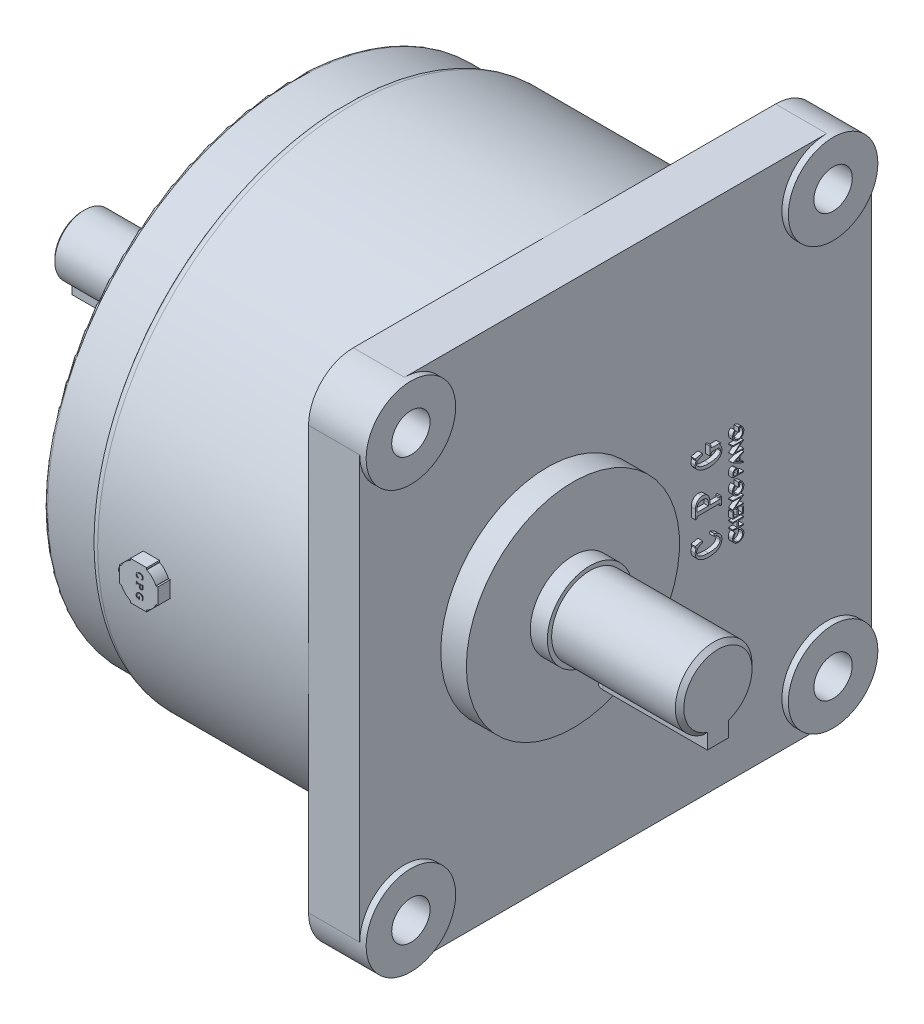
SolidWorks part; units mm, degrees
ref_plane "前视基准面" through (0, 0, 0) normal (0, 0, 1) x (1, 0, 0)
ref_plane "上视基准面" through (0, 0, 0) normal (0, 1, 0) x (1, 0, 0)
ref_plane "右视基准面" through (0, 0, 0) normal (1, 0, 0) x (0, 0, -1)
sketch "草图1" plane through (0, 0, 0) normal (0, 1, 0) x (1, 0, 0)
  line L0 (0, 0) -> (15.7361, 0) construction
  line L1 (0, 0) -> (0, -9)
  line L2 (0, -9) -> (-30, -9)
  line L3 (-30, -9) -> (-30, -10)
  line L4 (-30, -10) -> (-34, -10)
  line L5 (-34, -10) -> (-34, -25)
  line L6 (-34, -25) -> (-40, -25)
  line L7 (-40, -25) -> (-40, 0)
  line L8 (-40, 0) -> (0, 0)
  dimension "D1" = 30
  dimension "D2" = 18
  dimension "D3" = 20
  dimension "D4" = 6
  dimension "D5" = 50
  dimension "D6" = 40
revolve "旋转1" add sketch "草图1" angle 360 about L0
sketch "草图2" plane through (0, 0, 0) normal (0, 1, 0) x (1, 0, 0)
  line L0 (8.0167, 16) -> (-52, 16) construction
  line L1 (-40, 25) -> (-40, -25) construction
  line L4 (-52, 16) -> (-52, -44)
  line L5 (-52, -44) -> (-103.46, -44)
  line L6 (-103.46, 16) -> (-103.46, -44)
  line L11 (-52, 16) -> (-103.46, 16)
  dimension "D1" = 16
  dimension "D2" = 12
  dimension "D3" = 120
  dimension "D5" = 51.46
revolve "旋转2" add sketch "草图2" angle 360 about L0
sketch "草图12" plane through (-52, 0, 0) normal (1, 0, 0) x (0, 0, -1)
  line L0 (-44, -60) -> (76, 60) construction
  line L1 (-44, -60) -> (76, -60)
  line L2 (-44, -60) -> (-44, 60)
  line L3 (-44, 60) -> (76, 60)
  line L4 (76, -60) -> (76, 60)
  line L5 (-44, 60) -> (76, -60) construction
  circle A0 centre (16, 0) radius 60 construction
  point P4 (16, 0)
  dimension "D1" = 120
  dimension "D2" = 120
extrude "拉伸8" add sketch "草图12" along normal up to surface (12 mm away)
sketch "草图5" plane through (0, 0, 0) normal (0, 1, 0) x (1, 0, 0)
  line L0 (0, -2.5) -> (-24.5, -2.5)
  line L1 (0, -9) -> (0, 9) construction
  line L2 (-24.5, 2.5) -> (0, 2.5)
  line L3 (0, 2.5) -> (0, -2.5)
  line L4 (20.2, -13.7955) -> (20.2, 19.6443) construction
  arc A0 (-24.5, -2.5) -> (-24.5, 2.5) centre (-24.5, 0) cw
  dimension "D2" = 27
  dimension "D1" = 5
  dimension "D3" = 20.2
extrude "拉伸4" add sketch "草图5" against normal blind 11.2
fillet "圆角1" radius 2 1 edges at (-103.46, 0, -76)
chamfer "倒角1" distance 1 angle 45 1 edges at (0, 9, 0)
fillet "圆角3" radius 10.5 4 edges at (-46, 60, -76) (-46, -60, -76) (-46, -60, 44) (-46, 60, 44)
sketch "草图14" plane through (-40, 0, 0) normal (1, 0, 0) x (0, 0, -1)
  line L0 (-33.5, 60) -> (65.5, 60) construction
  line L1 (-44, -49.5) -> (-44, 49.5) construction
  line L2 (65.5, -60) -> (-33.5, -60) construction
  line L3 (76, 49.5) -> (76, -49.5) construction
  circle A0 centre (-33.5, 49.5) radius 10.5
  circle A1 centre (65.5, 49.5) radius 10.5
  circle A2 centre (-33.5, -49.5) radius 10.5
  circle A3 centre (65.5, -49.5) radius 10.5
  dimension "D1" = 21
extrude "拉伸10" add sketch "草图14" along normal blind 1.5
sketch "草图13" plane through (-38.5, 0, 0) normal (1, 0, 0) x (0, 0, -1)
  line L0 (-33.5, 49.4949) -> (65.5, 49.4949) construction
  line L1 (0, 0) -> (40.9287, 0) construction
  line L2 (-33.5, 60) -> (65.5, 60) construction
  circle A0 centre (-33.5, 49.4949) radius 4.5
  circle A1 centre (65.5, -49.4949) radius 4.5
  circle A2 centre (65.5, 49.4949) radius 4.5
  circle A3 centre (-33.5, -49.4949) radius 4.5
  circle A4 centre (16, 0) radius 70 construction
  dimension "D1" = 33.5
  dimension "D2" = 65.5
  dimension "D4" = 9
  dimension "D3" = 140
extrude "切除-拉伸3" cut sketch "草图13" against normal blind 15
sketch "草圖1" plane through (0, 0, 0) normal (0, 1, 0) x (1, 0, 0)
  line L0 (-141.504, 23) -> (-164.504, 23)
  line L1 (-164.504, 23) -> (-165.004, 22.5)
  line L2 (-165.004, 22.5) -> (-165.004, 16)
  line L3 (-138.004, 41.2) -> (-138.004, 23.25)
  line L4 (-140.004, 22.95) -> (-141.504, 22.95)
  line L5 (-140.004, 22.95) -> (-139.504, 23.25)
  line L6 (-139.504, 23.25) -> (-138.004, 23.25)
  line L7 (-103.96, 74) -> (-115.204, 74)
  line L8 (-129.3516, 42) -> (-137.204, 42)
  line L9 (-116.3837, 50.0851) -> (-128.7313, 42.2156)
  line L10 (-179.3544, 16) -> (-77.5909, 16) construction
  line L11 (-103.46, 73.5) -> (-103.46, 16)
  line L13 (-165.004, 16) -> (-103.46, 16)
  line L14 (-116.004, 73.2) -> (-116.004, 50.8695)
  line L15 (-141.504, 23) -> (-141.504, 22.95)
  arc A0 (-137.204, 42) -> (-138.004, 41.2) centre (-137.204, 41.2) ccw
  arc A3 (-129.3516, 42) -> (-128.7313, 42.2156) centre (-129.3516, 43) ccw
  arc A6 (-116.3837, 50.0851) -> (-116.004, 50.8695) centre (-117.004, 50.8695) ccw
  arc A7 (-115.204, 74) -> (-116.004, 73.2) centre (-115.204, 73.2) ccw
  arc A8 (-103.46, 73.5) -> (-103.96, 74) centre (-103.96, 73.5) ccw
  dimension "D1" = 16
  dimension "D2" = 116
  dimension "D3" = 14
  dimension "D4" = 25
  dimension "D5" = 165.004
revolve "旋轉1" add sketch "草圖1" angle 360 about L10
ref_plane "平面2" through (0, 0, -16) normal (0, 0, 1) x (1, 0, 0)
sketch "草圖4"
  dimension "D1" = 50
  dimension "D2" = 50
  dimension "D3" = 40
  dimension "D4" = 45
  dimension "D5" = 25
extrude "伸長2" add sketch "草圖4" along normal blind 1
sketch "草圖5" plane through (0, 0, 0) normal (0, 1, 0) x (1, 0, 0)
  line L0 (-183.3212, 16) -> (-131.339, 16) construction
  line L1 (-165.004, 13.5) -> (-145.504, 13.5)
  line L2 (-165.004, 22.5) -> (-165.004, 9.5) construction
  line L3 (-145.504, 18.5) -> (-165.004, 18.5)
  line L4 (-165.004, 18.5) -> (-165.004, 13.5)
  line L5 (-143.004, 16) -> (-143.004, 4.7725) construction
  line L6 (-181.204, 16) -> (-181.204, 7.1164) construction
  arc A0 (-145.504, 13.5) -> (-145.504, 18.5) centre (-145.504, 16) ccw
  dimension "D1" = 7
  dimension "D2" = 22
  dimension "D3" = 5
  dimension "D4" = 2.5
  dimension "D5" = 16.2
extrude "伸長3" add sketch "草圖5" against normal blind 9.2
ref_plane "平面3" through (0, 0, 46.9) normal (0, 0, 1) x (1, 0, 0)
sketch "草圖6" plane through (0, 0, 46.9) normal (0, 0, 1) x (1, 0, 0)
  line L0 (-90.8547, 4.5) -> (-87.0653, 4.5)
  line L2 (-90.8547, 4.1268) -> (-90.8547, 4.5)
  line L3 (-87.0653, 4.1268) -> (-87.0653, 4.5)
  line L4 (-93.0868, 1.8947) -> (-93.46, 1.8947)
  line L5 (-93.0868, -1.8947) -> (-93.46, -1.8947)
  line L6 (-93.46, -1.8947) -> (-93.46, 1.8947)
  line L7 (-90.8547, -4.1268) -> (-90.8547, -4.5)
  line L8 (-87.0653, -4.1268) -> (-87.0653, -4.5)
  line L9 (-87.0653, -4.5) -> (-90.8547, -4.5)
  line L10 (-84.8332, -1.8947) -> (-84.46, -1.8947)
  line L11 (-84.8332, 1.8947) -> (-84.46, 1.8947)
  line L12 (-84.46, 1.8947) -> (-84.46, -1.8947)
  arc A0 (-90.8952, 4.0626) -> (-93.0226, 1.9352) centre (-88.96, 0) ccw
  arc A1 (-90.8952, 4.0626) -> (-90.8547, 4.1268) centre (-90.9258, 4.1268) ccw
  arc A2 (-87.0653, 4.1268) -> (-87.0248, 4.0626) centre (-86.9942, 4.1268) ccw
  arc A3 (-93.0868, 1.8947) -> (-93.0226, 1.9352) centre (-93.0868, 1.9658) ccw
  arc A4 (-93.0226, -1.9352) -> (-93.0868, -1.8947) centre (-93.0868, -1.9658) ccw
  arc A5 (-90.8547, -4.1268) -> (-90.8952, -4.0626) centre (-90.9258, -4.1268) ccw
  arc A6 (-87.0248, -4.0626) -> (-87.0653, -4.1268) centre (-86.9942, -4.1268) ccw
  arc A7 (-84.8332, -1.8947) -> (-84.8974, -1.9352) centre (-84.8332, -1.9658) ccw
  arc A8 (-84.8974, 1.9352) -> (-84.8332, 1.8947) centre (-84.8332, 1.9658) ccw
  arc A9 (-93.0226, -1.9352) -> (-90.8952, -4.0626) centre (-88.96, 0) ccw
  arc A10 (-87.0248, -4.0626) -> (-84.8974, -1.9352) centre (-88.96, 0) ccw
  arc A11 (-84.8974, 1.9352) -> (-87.0248, 4.0626) centre (-88.96, 0) ccw
extrude "伸長4" add sketch "草圖6" against normal blind 3
sketch "草圖7"
extrude "伸長5" add sketch "草圖7" along normal blind 0.15
sketch "草圖8" plane through (0, 0, 0) normal (0, 1, 0) x (1, 0, 0)
  line L0 (-93.0737, -45.8828) -> (-91.3355, -45.7863)
  line L1 (-93.8463, -45.8828) -> (-93.0737, -45.8828)
  line L2 (-93.8463, -46.1725) -> (-93.8463, -45.8828)
  line L3 (-94.4257, -46.1725) -> (-94.4257, -45.4)
  line L4 (-94.4257, -46.1725) -> (-93.8463, -46.1725)
  line L5 (-91.3355, -45.7863) -> (-91.3355, -45.4)
  line L6 (-91.3355, -45.4) -> (-94.4257, -45.4)
  line L8 (-93.0226, -46.9) -> (-90.8952, -46.9) construction
  dimension "D1" = 1.5
revolve "旋轉2" add sketch "草圖8" angle 360 about L6
equation "\"D3@草图1\" = \"D2@草图1\"+2"
equation "\"D1@拉伸4\" = \"D3@草图5\"-\"D2@草图1\"/2"
equation "\"D1@伸長3\" = \"D5@草圖5\"-\"D3@草圖1\"/2"
